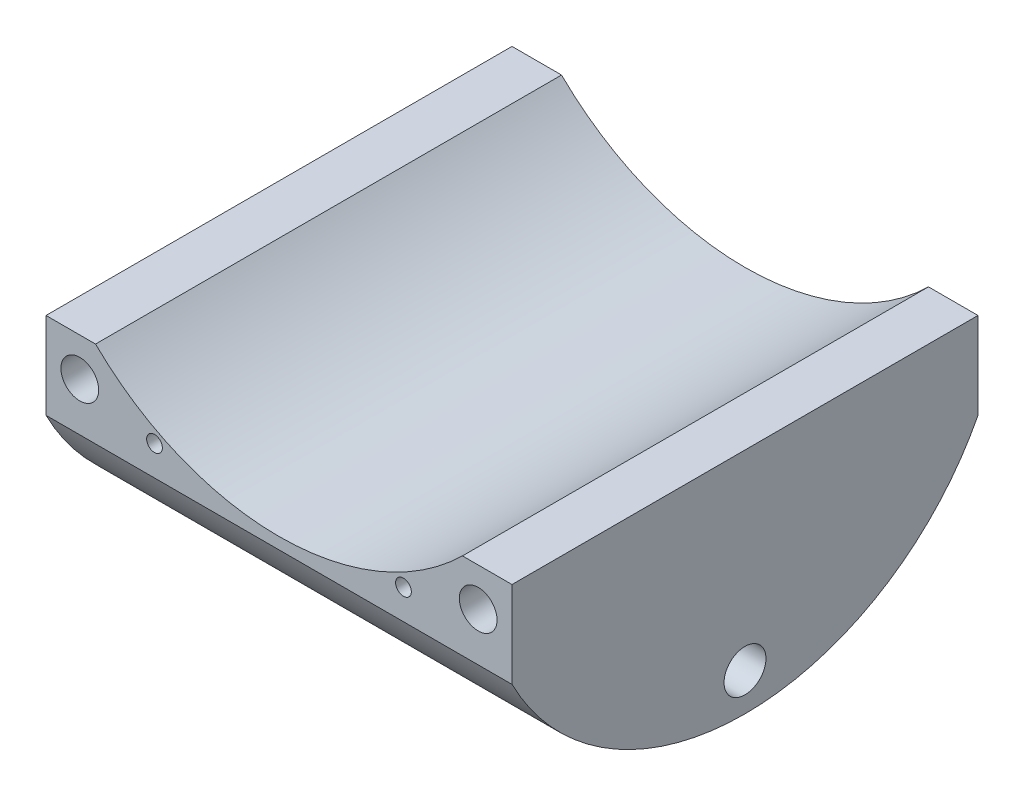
SolidWorks part; units mm, degrees
ref_plane "Front Plane" through (0, 0, 0) normal (0, 0, 1) x (1, 0, 0)
ref_plane "Top Plane" through (0, 0, 0) normal (0, 1, 0) x (1, 0, 0)
ref_plane "Right Plane" through (0, 0, 0) normal (1, 0, 0) x (0, 0, -1)
sketch "Sketch1" plane through (0, 0, 0) normal (1, 0, 0) x (0, 0, -1)
  line L0 (0, 0) -> (0, -68.6697) construction
  line L1 (-44.45, 0) -> (44.45, 0)
  line L2 (-44.45, 0) -> (-44.45, -16.5)
  line L4 (44.45, 0) -> (44.45, -16.5)
  arc A0 (-44.45, -16.5) -> (44.45, -16.5) centre (0, 6.3954) ccw
  dimension "D1" = 50
  dimension "D2" = 88.9
  dimension "D3" = 16.5
extrude "Boss-Extrude1" add sketch "Sketch1" along normal mid plane 88.9
sketch "Sketch2" plane through (0, 0, -44.45) normal (0, 0, -1) x (-1, 0, 0)
  line L0 (-44.45, 0) -> (44.45, 0) construction
  line L1 (-35, 0) -> (35, 0)
  line L2 (0, 0) -> (0, 48.2295) construction
  arc A0 (-35, 0) -> (35, 0) centre (0, 35.7071) ccw
  dimension "D1" = 50
  dimension "D2" = 70
extrude "Cut-Extrude1" cut sketch "Sketch2" against normal through all
sketch "Sketch3" plane through (44.45, 0, 0) normal (1, 0, 0) x (0, 0, -1)
  line L0 (44.45, 0) -> (-44.45, 0) construction
  circle A0 centre (0, -36.45) radius 4
  dimension "D1" = 8
  dimension "D2" = 36.45
extrude "Cut-Extrude2" cut sketch "Sketch3" against normal blind 17.5
mirror "Mirror1" about plane through (0, 0, 0) normal (1, 0, 0) of "Cut-Extrude2"
hole_wizard "Ø7.2 (7.2) Diameter Hole1" positions "Sketch5" profile "Sketch4" hole size "Ø7.2" standard "ANSI Metric"
sketch "Sketch5" plane through (0, 0, -44.45) normal (0, 0, -1) x (-1, 0, 0)
  line L0 (-44.45, 0) -> (-35, 0) construction
  point P0 (-38, -7.3)
  dimension "D1" = 38
  dimension "D2" = 7.3
sketch "Sketch4" plane through (38, -7.3, -44.45) normal (1, 0, 0) x (0, 1, 0)
  line L0 (0, 0) -> (0, 22.8131)
  line L1 (0, 22.8131) -> (3.6, 20.65)
  line L2 (3.6, 20.65) -> (3.6, 0)
  line L5 (3.6, 0) -> (0, 0)
  line L10 (0, 22.8131) -> (-3.6, 20.65) construction
  line L11 (0, -6.35) -> (0, 107.95) construction
  dimension "Hole Dia." = 7.2
  dimension "Hole Depth" = 20.65
  dimension "Drill Angle" = 118
mirror "Mirror2" about plane through (0, 0, 0) normal (1, 0, 0) of "Ø7.2 (7.2) Diameter Hole1"
mirror "Mirror3" about plane through (0, 0, 0) normal (0, 0, 1) of "Mirror2", "Ø7.2 (7.2) Diameter Hole1"
sketch "Sketch6" plane through (0, 0, 44.45) normal (0, 0, 1) x (1, 0, 0)
  line L0 (-35, 0) -> (-44.45, 0) construction
  line L1 (-44.45, 0) -> (-44.45, -16.5) construction
  circle A0 centre (-23.75, -10.8) radius 1.5
  circle A1 centre (23.75, -10.8) radius 1.5
  dimension "D3" = 3
  dimension "D1" = 10.8
  dimension "D2" = 20.7
  dimension "D4" = 47.5
extrude "Cut-Extrude3" cut sketch "Sketch6" against normal blind 14.5
mirror "Mirror4" about plane through (0, 0, 0) normal (0, 0, 1) of "Cut-Extrude3"
